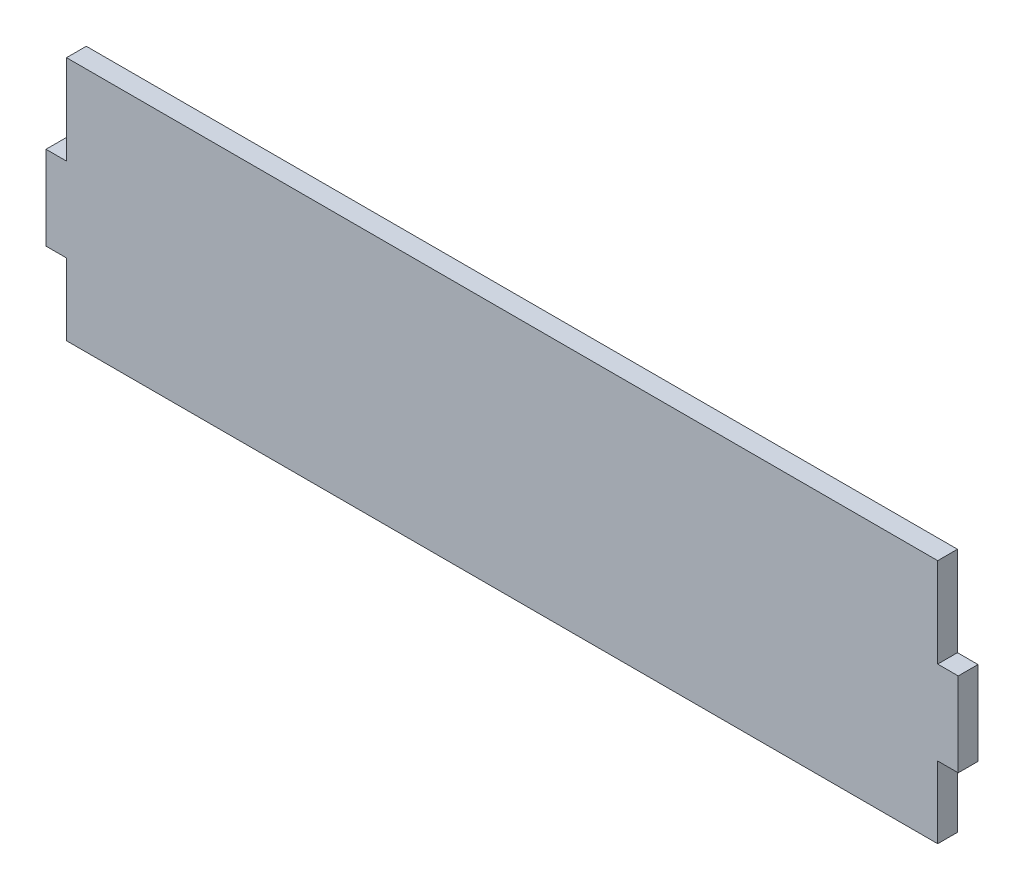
SolidWorks part; units mm, degrees
ref_plane "Alzado" through (0, 0, 0) normal (0, 0, 1) x (1, 0, 0)
ref_plane "Planta" through (0, 0, 0) normal (0, 1, 0) x (1, 0, 0)
ref_plane "Vista lateral" through (0, 0, 0) normal (1, 0, 0) x (0, 0, -1)
sketch "Croquis1" plane through (0, 0, 0) normal (0, 0, 1) x (1, 0, 0)
  line L15 (48.05, 12.4612) -> (-66.55, 12.4612)
  line L18 (-87.5775, 0.6768) -> (-87.5627, 0.6768)
  line L20 (50.75, 0.6768) -> (48.05, 0.6768)
  line L21 (48.05, 0.6768) -> (48.05, 12.4612)
  line L22 (-87.5775, 0.6768) -> (-87.5627, 0.6768)
  line L23 (-66.55, 0.6768) -> (-66.55, 12.4612)
  line L25 (50.75, 0.6768) -> (50.75, -10.3614)
  line L26 (-69.25, -10.3614) -> (-69.25, 0.6768)
  line L27 (-69.25, 0.6768) -> (-66.55, 0.6768)
  line L28 (-66.55, -10.3614) -> (-69.25, -10.3614)
  line L29 (50.75, -10.3614) -> (48.05, -10.3614)
  line L30 (48.05, -19.7909) -> (48.05, -10.3614)
  line L32 (-66.55, -19.7909) -> (-66.55, -10.3614)
  line L33 (48.05, -19.7909) -> (-66.55, -19.7909)
extrude "Saliente-Extruir1" add sketch "Croquis1" along normal blind 2.6
